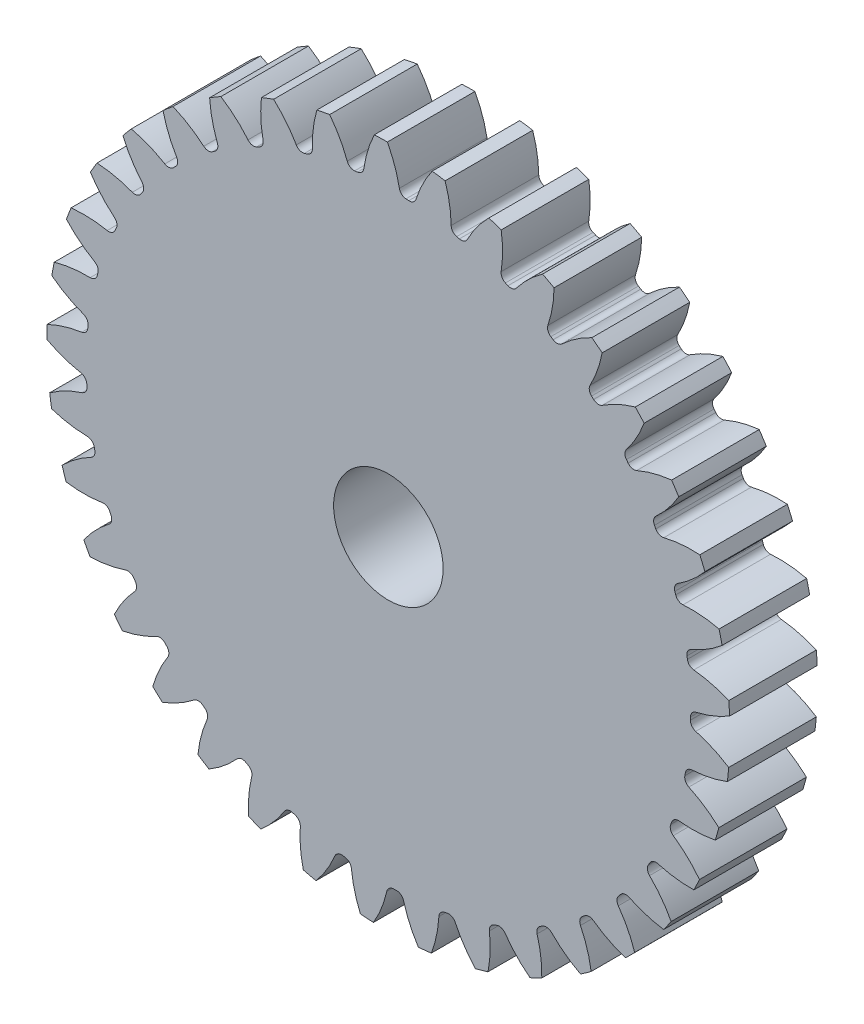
SolidWorks part; units mm, degrees
ref_plane "Front" through (0, 0, 0) normal (0, 0, 1) x (1, 0, 0)
ref_plane "Top" through (0, 0, 0) normal (0, 1, 0) x (1, 0, 0)
ref_plane "Right" through (0, 0, 0) normal (1, 0, 0) x (0, 0, -1)
sketch "Sketch3" plane through (0, 0, 0) normal (0, 0, 1) x (1, 0, 0)
  circle A0 centre (0, 0) radius 396.24
  dimension "od" = 792.48
extrude "gearBody" add sketch "Sketch3" along normal blind 101.6
sketch "Sketch2" plane through (0, 0, 0) normal (0, 0, 1) x (1, 0, 0)
  line L0 (0, 0) -> (326.3598, 135.1826) construction
  line L1 (395.1703, -34.3431) -> (0, 0) construction
  line L2 (0, 0) -> (36.3143, 0) construction
  line L3 (375.8293, 8.2553) -> (375.1827, -23.5322) construction
  line L5 (375.506, -7.6384) -> (0, 0) construction
  line L7 (0, 0) -> (353.2493, 0) construction
  arc A0 (353.2455, 1.6351) -> (352.8868, -15.999) centre (0, 0) ccw construction
  arc A1 (395.8309, 18.001) -> (394.7714, -34.0832) centre (0, 0) ccw construction
  arc A2 (375.8293, 8.2553) -> (375.1827, -23.5322) centre (0, 0) ccw construction
  arc A3 (350.4108, -8.7488) -> (350.4767, -5.5085) centre (0, 0) ccw
  arc A4 (395.1703, -34.3431) -> (356.4986, -16.933) centre (320.5924, -148.3428) ccw
  arc A5 (395.1703, -34.3431) -> (396.24, 18.2445) centre (0, 0) ccw
  arc A6 (396.24, 18.2445) -> (356.8923, 2.4214) centre (326.3598, 135.1826) cw
  arc A7 (350.4767, -5.5085) -> (356.8923, 2.4214) centre (358.7459, -5.6385) cw
  arc A8 (356.4986, -16.933) -> (350.4108, -8.7488) centre (358.6785, -8.9552) cw
  point P6 (396.24, 18.2445)
  point P22 (395.1703, -34.3431)
  dimension "baseDia" = 706.4985
  dimension "od" = 792.48
  dimension "pd" = 751.84
  dimension "rd" = 701.04
  dimension "rFillet" = 8.2702
  dimension "pointX" = 396.24
  dimension "pointY" = 18.2445
  dimension "CTT" = 31.7875
  dimension "flankCenterAngle" = 22.5
extrude "toothCut" cut sketch "Sketch2" along normal through all
pattern_circular "CirPattern1" count 37 over 360 about axis through (0, 0, 0) along (0, 0, 1) of "toothCut"
sketch "hub1Dia" plane through (0, 0, 0) normal (0, 0, -1) x (-1, 0, 0)
  circle A0 centre (0, 0) radius 12.7
  dimension "hub1Dia" = 25.4
sketch "hub2Dia" plane through (0, 0, 101.6) normal (0, 0, 1) x (1, 0, 0)
  circle A0 centre (0, 0) radius 12.7
  dimension "hub2dia" = 25.4
sketch "boreDia" plane through (0, 0, 0) normal (0, 0, 1) x (1, 0, 0)
  circle A0 centre (0, 0) radius 63.5
  dimension "boreDia" = 127
extrude "bore" cut sketch "boreDia" against normal mid plane 25400
